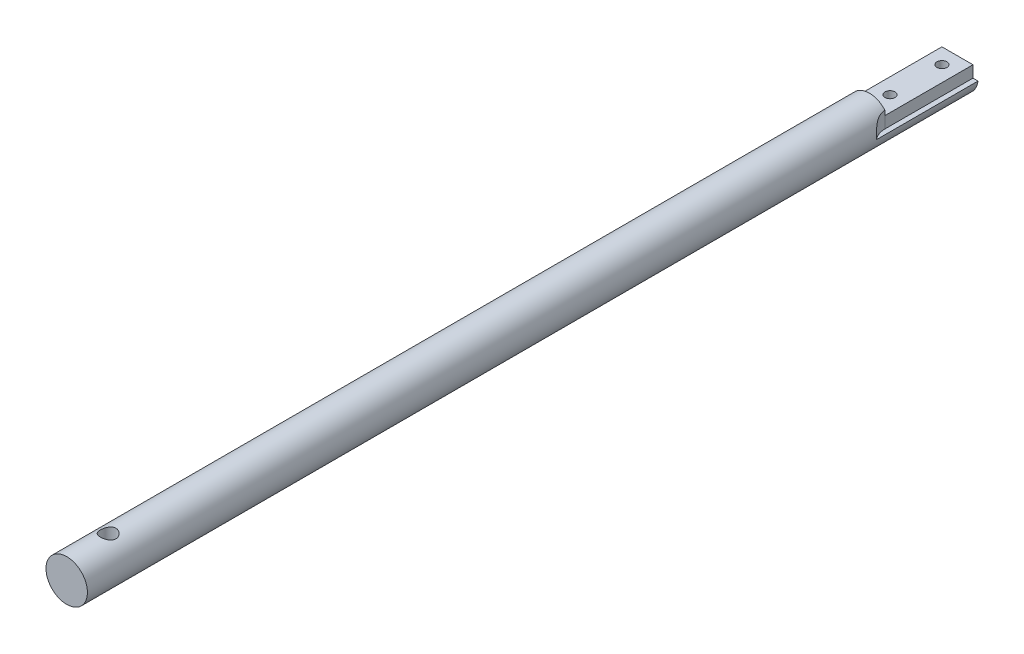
SolidWorks part; units mm, degrees
ref_plane "Front" through (0, 0, 0) normal (0, 0, 1) x (1, 0, 0)
ref_plane "Top" through (0, 0, 0) normal (0, 1, 0) x (1, 0, 0)
ref_plane "Right" through (0, 0, 0) normal (1, 0, 0) x (0, 0, -1)
sketch "Sketch1" plane through (0, 0, 0) normal (0, 0, -1) x (-1, 0, 0)
  circle A1 centre (0, 0) radius 3.175
extrude "Extrude1" add sketch "Sketch1" against normal blind 136.525
sketch "Sketch3" plane through (0, 0, 0) normal (0, 0, -1) x (-1, 0, 0)
  line L0 (11.2395, -0.3889) -> (2.3812, -0.3889) construction
  line L1 (2.3812, 1.3891) -> (2.3812, -0.3889) construction
  line L2 (-2.3813, 1.3891) -> (2.3812, 1.3891) construction
  line L3 (-2.3813, -0.3889) -> (-2.3813, 1.3891) construction
  line L4 (-2.3813, -0.3889) -> (-4.6355, -0.3889) construction
  line L5 (4.8895, -0.3889) -> (2.3812, -0.3889)
  line L6 (2.3812, 1.3891) -> (2.3812, -0.3889)
  line L7 (-2.3813, 1.3891) -> (2.3812, 1.3891)
  line L8 (-2.3813, -0.3889) -> (-2.3813, 1.3891)
  line L9 (-2.3813, -0.3889) -> (-4.6355, -0.3889)
  line L10 (-4.6355, -0.3889) -> (-4.6355, 4.3736)
  line L11 (-4.6355, 4.3736) -> (4.8895, 4.3736)
  line L12 (4.8895, 4.3736) -> (4.8895, -0.3889)
  dimension "D1" = 9.525
  dimension "D2" = 4.7625
  dimension "D3" = 1.3891
  dimension "D4" = 4.7625
  dimension "D5" = 2.3813
  dimension "D6" = 1.778
extrude "Cut-Extrude1" cut sketch "Sketch3" against normal blind 13.4937
sketch "Sketch4" plane through (0, -0.3889, 0) normal (0, 1, 0) x (-1, 0, 0)
  line L0 (0, 0) -> (0, 7.063) construction
  line L1 (-2.3813, 10.3189) -> (-8.7312, 10.3189)
  line L2 (-2.3813, 10.3189) -> (-2.3813, 13.4939)
  line L3 (-5.5563, 16.6689) -> (-8.7313, 16.6689)
  line L4 (-8.7312, 10.3189) -> (-8.7313, 16.6689)
  line L5 (-2.3813, 13.4937) -> (-2.3813, 0) construction
  line L6 (-2.3813, 13.4937) -> (2.3812, 13.4937) construction
  line L7 (8.7312, 10.3189) -> (8.7313, 16.6689)
  line L8 (5.5563, 16.6689) -> (8.7313, 16.6689)
  line L9 (2.3813, 10.3189) -> (2.3813, 13.4939)
  line L10 (2.3813, 10.3189) -> (8.7312, 10.3189)
  arc A0 (-2.3813, 13.4939) -> (-5.5563, 16.6689) centre (-5.5563, 13.4939) ccw
  arc A1 (2.3813, 13.4939) -> (5.5563, 16.6689) centre (5.5563, 13.4939) cw
  point P13 (-2.3813, 16.6689)
  dimension "D3" = 3.175
  dimension "D1" = 6.35
  dimension "D2" = 6.35
  dimension "D4" = 0.0001
extrude "Cut-Extrude2" cut sketch "Sketch4" along normal through all
hole_wizard "#0-80 Tapped Hole1" positions "Sketch6" profile "Sketch5" tap size "#0-80" standard "Ansi Inch"
sketch "Sketch6" plane through (0, 1.3891, 0) normal (0, 1, 0) x (-1, 0, 0)
  point P0 (0.0036, 10.3378)
  point P1 (0.0159, 2.3622)
sketch "Sketch5" plane through (-0.0036, 1.3891, 10.3378) normal (1, 0, 0) x (0, 0, 1)
  line L0 (0, 0) -> (0, 4.5641)
  line L1 (0, 4.5641) -> (0.762, 4.5641)
  line L2 (0.762, 4.5641) -> (0.762, 0)
  line L5 (0.762, 0) -> (0, 0)
  line L11 (0, -6.35) -> (0, 107.95) construction
  dimension "Thread Major Dia." = 1.524
  dimension "Thru Tap Drill Depth" = 4.5641
ref_plane "Plane1" through (0, -3.2004, 0) normal (0, 1, 0) x (-1, 0, 0)
hole_wizard "3/32 (0.09375) PF DWL Diameter Hole3" positions "Sketch9" profile "Sketch8" hole size "3/32" standard "Ansi Inch"
sketch "Sketch9" plane through (0, -3.2004, 0) normal (0, 1, 0) x (-1, 0, 0)
  line L0 (0, 136.525) -> (0, 13.4937) construction
  line L1 (3.175, 136.525) -> (-3.175, 136.525) construction
  point P1 (0, 130.175)
  dimension "D1" = 6.35
sketch "Sketch8" plane through (0, -3.2004, 130.175) normal (1, 0, 0) x (0, 0, -1)
  line L0 (0, 0) -> (0, 6.3754)
  line L1 (0, 6.3754) -> (1.1874, 6.3754)
  line L2 (1.1874, 6.3754) -> (1.1874, 0)
  line L5 (1.1874, 0) -> (0, 0)
  line L11 (0, -6.35) -> (0, 107.95) construction
  dimension "Thru Hole Dia." = 2.3749
  dimension "Thru Hole Depth" = 6.3754
